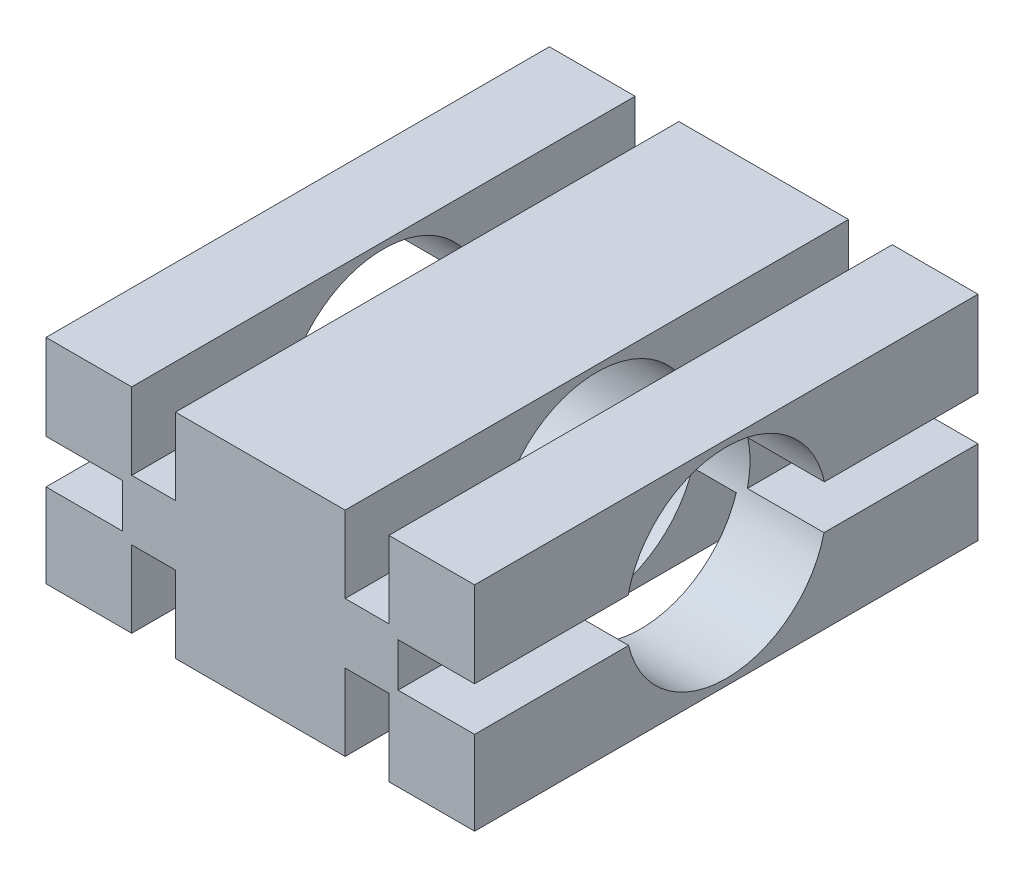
SolidWorks part; units mm, degrees
ref_plane "Front Plane" through (0, 0, 0) normal (0, 0, 1) x (1, 0, 0)
ref_plane "Top Plane" through (0, 0, 0) normal (0, 1, 0) x (1, 0, 0)
ref_plane "Right Plane" through (0, 0, 0) normal (1, 0, 0) x (0, 0, -1)
sketch "Sketch1" plane through (0, 0, 0) normal (0, 0, 1) x (1, 0, 0)
  line L0 (59.69, 29.718) -> (47.752, 29.718) construction
  line L1 (0, 0) -> (11.938, 0)
  line L2 (0, 0) -> (0, 11.684)
  line L3 (0, 29.718) -> (11.938, 29.718)
  line L4 (59.69, 0) -> (59.69, 11.684)
  line L5 (47.752, 29.718) -> (47.752, 19.05) construction
  line L6 (47.752, 19.05) -> (41.656, 19.05) construction
  line L7 (59.69, 29.718) -> (59.69, 17.78) construction
  line L9 (47.752, 29.718) -> (47.752, 19.05)
  line L10 (47.752, 19.05) -> (41.656, 19.05)
  line L11 (41.656, 29.718) -> (41.656, 19.05)
  line L12 (59.69, 17.78) -> (49.022, 17.78) construction
  line L13 (49.022, 17.78) -> (49.022, 11.684) construction
  line L14 (10.668, 14.859) -> (59.69, 14.859) construction
  line L15 (59.69, 17.78) -> (49.022, 17.78)
  line L17 (59.69, 11.684) -> (49.022, 11.684)
  line L18 (49.022, 17.78) -> (49.022, 11.684)
  line L19 (29.845, 29.718) -> (29.845, 0) construction
  line L20 (47.752, 10.668) -> (41.656, 10.668)
  line L21 (41.656, 0) -> (41.656, 10.668)
  line L23 (47.752, 0) -> (47.752, 10.668)
  line L24 (11.938, 0) -> (11.938, 10.668)
  line L26 (18.034, 0) -> (18.034, 10.668)
  line L27 (11.938, 10.668) -> (18.034, 10.668)
  line L28 (11.938, 19.05) -> (18.034, 19.05)
  line L29 (18.034, 29.718) -> (18.034, 19.05)
  line L31 (11.938, 29.718) -> (11.938, 19.05)
  line L32 (0, 11.684) -> (10.668, 11.684)
  line L33 (10.668, 17.78) -> (10.668, 11.684)
  line L34 (0, 17.78) -> (10.668, 17.78)
  line L36 (59.69, 17.78) -> (59.69, 29.718)
  line L37 (47.752, 29.718) -> (59.69, 29.718)
  line L38 (18.034, 29.718) -> (41.656, 29.718)
  line L39 (0, 17.78) -> (0, 29.718)
  line L40 (18.034, 0) -> (41.656, 0)
  line L41 (47.752, 0) -> (59.69, 0)
  dimension "D1" = 59.69
  dimension "D2" = 29.718
  dimension "D3" = 11.938
  dimension "D4" = 6.096
  dimension "D5" = 11.938
  dimension "D6" = 6.096
  dimension "D7" = 10.668
extrude "Boss-Extrude1" add sketch "Sketch1" along normal blind 70.104
sketch "Sketch2" plane through (0, 0, 0) normal (-1, 0, 0) x (0, 0, 1)
  line L0 (0, 29.718) -> (70.104, 0) construction
  line L1 (70.104, 0) -> (70.104, 29.718) construction
  line L2 (70.104, 29.718) -> (0, 0) construction
  circle A0 centre (35.052, 14.859) radius 13.97
extrude "Cut-Extrude1" cut sketch "Sketch2" against normal through all
